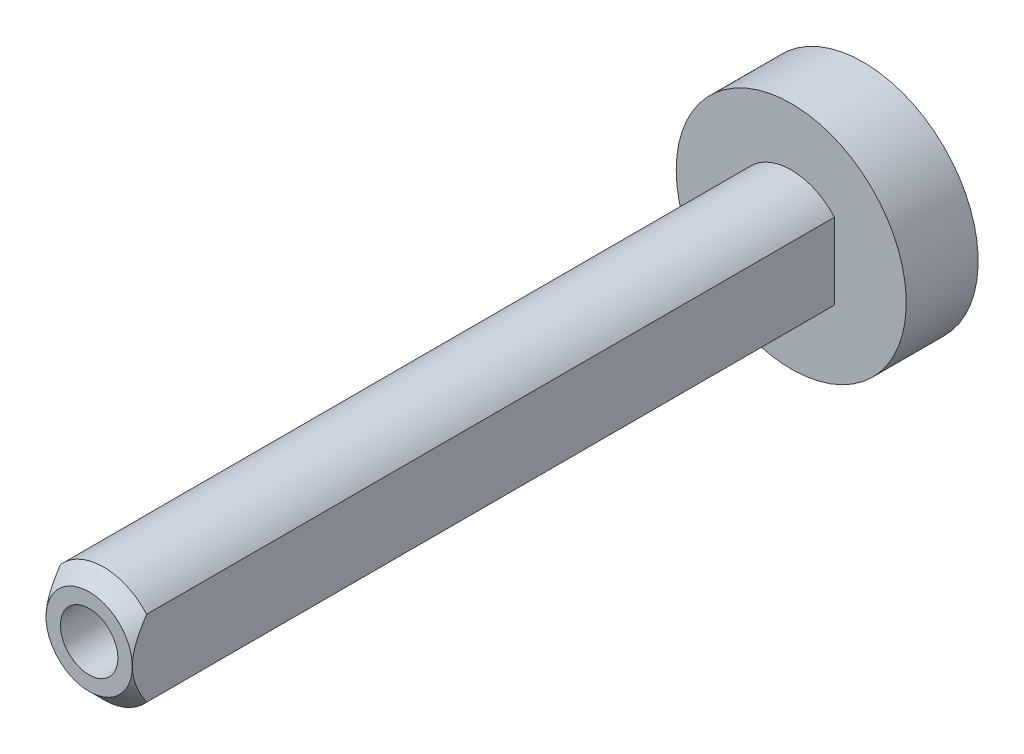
SolidWorks part; units mm, degrees
ref_plane "Front" through (0, 0, 0) normal (0, 0, 1) x (1, 0, 0)
ref_plane "Top" through (0, 0, 0) normal (0, 1, 0) x (1, 0, 0)
ref_plane "Right" through (0, 0, 0) normal (1, 0, 0) x (0, 0, -1)
sketch "Sketch1" plane through (0, 0, 0) normal (0, 0, 1) x (1, 0, 0)
  circle A0 centre (0, 0) radius 4
  dimension "D1" = 8
extrude "Base-Extrude" add sketch "Sketch1" along normal blind 53.83
chamfer "Chamfer1" distance 1 angle 45 1 edges at (4, 0, 53.83)
sketch "Sketch2" plane through (0, 0, 53.83) normal (0, 0, 1) x (1, 0, 0)
  circle A0 centre (0, 0) radius 2
  dimension "D1" = 4
extrude "Internal Thread" cut sketch "Sketch2" against normal blind 8
sketch "Sketch3" plane through (0, 0, 0) normal (0, 0, -1) x (-1, 0, 0)
  line L0 (0, 0) -> (0, 3.1993) construction
  line L2 (3, 2.6458) -> (3, -2.6458)
  line L3 (-3, 2.6458) -> (-3, -2.6458)
  arc A0 (3, -2.6458) -> (3, 2.6458) centre (0, 0) ccw
  circle A1 centre (0, 0) radius 4
  arc A2 (-3, 2.6458) -> (-3, -2.6458) centre (0, 0) ccw
  dimension "D2" = 6
  dimension "D1" = 0
extrude "Wrench Flats" cut sketch "Sketch3" against normal through all
sketch "Sketch4" plane through (0, 0, 0) normal (0, 0, -1) x (-1, 0, 0)
  line L2 (-3, 2.6458) -> (-3, -2.6458)
  line L3 (3, -2.6458) -> (3, 2.6458)
  line L4 (-3, 2.6458) -> (-3, -2.6458)
  line L5 (3, -2.6458) -> (3, 2.6458)
  line L8 (-2, 2.2361) -> (-2, -2.2361)
  line L9 (2, -2.2361) -> (2, 2.2361)
  line L10 (-2, 2.2361) -> (-2, -2.2361)
  line L11 (2, -2.2361) -> (2, 2.2361)
  arc A2 (3, 2.6458) -> (-3, 2.6458) centre (0, 0) ccw
  arc A3 (-3, -2.6458) -> (3, -2.6458) centre (0, 0) ccw
  arc A4 (3, 2.6458) -> (-3, 2.6458) centre (0, 0) ccw
  arc A5 (-3, -2.6458) -> (3, -2.6458) centre (0, 0) ccw
  arc A8 (2, 2.2361) -> (-2, 2.2361) centre (0, 0) ccw
  arc A9 (-2, -2.2361) -> (2, -2.2361) centre (0, 0) ccw
  arc A10 (2, 2.2361) -> (-2, 2.2361) centre (0, 0) ccw
  arc A11 (-2, -2.2361) -> (2, -2.2361) centre (0, 0) ccw
  dimension "D1" = 0
  dimension "D2" = 1
extrude "Back Cut" cut sketch "Sketch4" against normal blind 1
sketch "Sketch5" plane through (0, 0, 0) normal (0, 0, -1) x (-1, 0, 0)
  line L0 (-3, 2.6458) -> (-3, -2.6458) construction
  line L1 (-3, 2.6458) -> (-3, -2.6458)
  line L2 (3, -2.6458) -> (3, 2.6458) construction
  line L3 (3, -2.6458) -> (3, 2.6458)
  circle A0 centre (0, 0) radius 8
  arc A1 (-3, -2.6458) -> (3, -2.6458) centre (0, 0) ccw construction
  arc A2 (-3, -2.6458) -> (3, -2.6458) centre (0, 0) ccw
  arc A3 (3, 2.6458) -> (-3, 2.6458) centre (0, 0) ccw construction
  arc A4 (3, 2.6458) -> (-3, 2.6458) centre (0, 0) ccw
  point P7 (-5.9317, -0.4842)
  dimension "D2" = 16
extrude "Piston" add sketch "Sketch5" against normal blind 5
